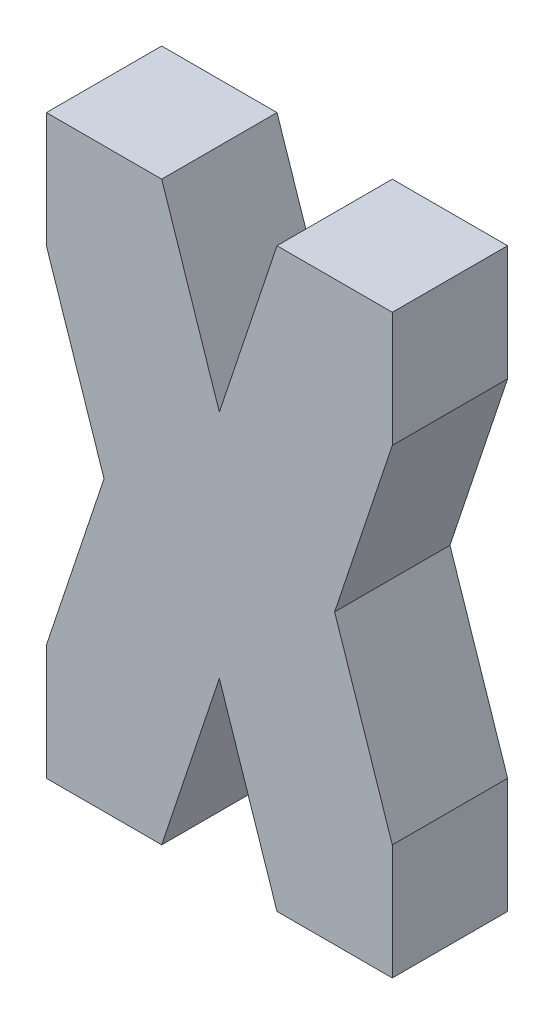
SolidWorks part; units mm, degrees
ref_plane "Plan de face" through (0, 0, 0) normal (0, 0, 1) x (1, 0, 0)
ref_plane "Plan de dessus" through (0, 0, 0) normal (0, 1, 0) x (1, 0, 0)
ref_plane "Plan de droite" through (0, 0, 0) normal (1, 0, 0) x (0, 0, -1)
sketch "Esquisse1" plane through (0, 0, 0) normal (0, 0, 1) x (1, 0, 0)
  line L0 (10, 50) -> (15, 35)
  line L1 (0, 0) -> (10, 0)
  line L2 (0, 0) -> (0, 10)
  line L3 (0, 50) -> (10, 50)
  line L4 (30, 0) -> (30, 10)
  line L5 (15, 35) -> (20, 50)
  line L6 (0, 40) -> (5, 25)
  line L7 (5, 25) -> (0, 10)
  line L8 (30, 40) -> (25, 25)
  line L9 (25, 25) -> (30, 10)
  line L10 (10, 0) -> (15, 15)
  line L11 (15, 15) -> (20, 0)
  line L12 (20, 50) -> (30, 50)
  line L13 (0, 40) -> (0, 50)
  line L14 (30, 40) -> (30, 50)
  line L15 (20, 0) -> (30, 0)
  dimension "D1" = 30
  dimension "D2" = 50
  dimension "D3" = 10
  dimension "D4" = 10
  dimension "D5" = 10
  dimension "D6" = 10
  dimension "D7" = 10
  dimension "D8" = 10
  dimension "D9" = 10
  dimension "D10" = 10
  dimension "D11" = 25
  dimension "D12" = 25
  dimension "D13" = 15
  dimension "D14" = 15
  dimension "D15" = 15
  dimension "D16" = 15
extrude "Boss.-Extru.1" add sketch "Esquisse1" along normal blind 10
